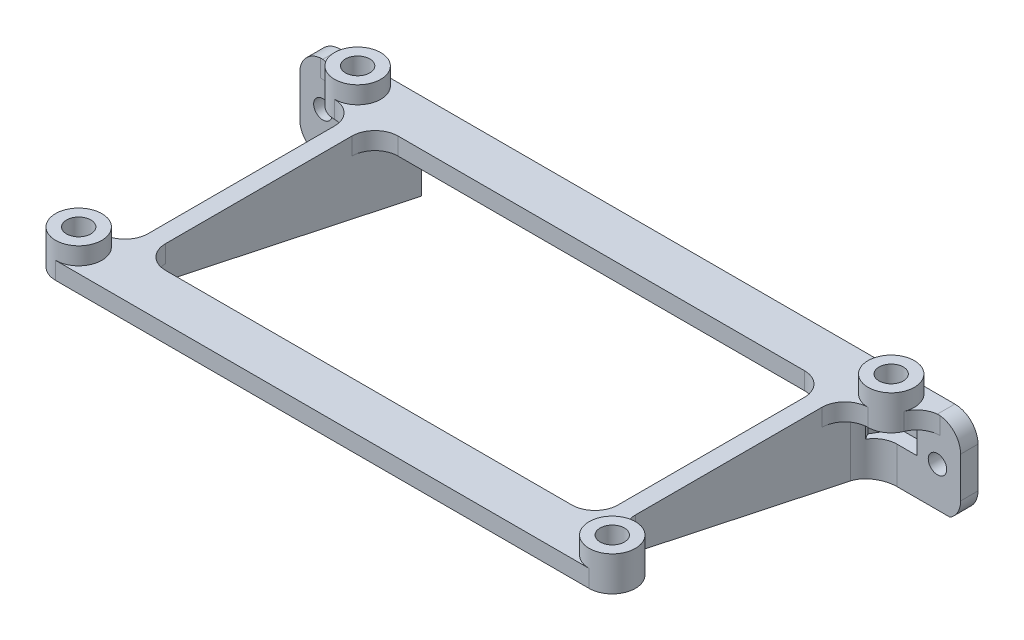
SolidWorks part; units mm, degrees
ref_plane "Front Plane" through (0, 0, 0) normal (0, 0, 1) x (1, 0, 0)
ref_plane "Top Plane" through (0, 0, 0) normal (0, 1, 0) x (1, 0, 0)
ref_plane "Right Plane" through (0, 0, 0) normal (1, 0, 0) x (0, 0, -1)
sketch "Sketch3" plane through (0, 0, 0) normal (0, 1, 0) x (1, 0, 0)
  line L0 (0, 0) -> (92.2, 0) construction
  line L1 (0, 0) -> (0, -48.2) construction
  circle A0 centre (0, 0) radius 2.1
  circle A1 centre (0, 0) radius 4
  circle A2 centre (92.2, 0) radius 2.1
  circle A3 centre (92.2, 0) radius 4
  circle A4 centre (92.2, -48.2) radius 2.1
  circle A5 centre (92.2, -48.2) radius 4
  circle A6 centre (0, -48.2) radius 2.1
  circle A7 centre (0, -48.2) radius 4
  dimension "D1" = 4.2
  dimension "D2" = 8
  dimension "D5" = 92.2
  dimension "D6" = 48.2
  dimension "D3" = 2
  dimension "D4" = 2
extrude "Boss-Extrude2" add sketch "Sketch3" along normal blind 3
sketch "Sketch4" plane through (0, 0, 0) normal (0, 1, 0) x (1, 0, 0)
  line L0 (46.1, 4) -> (46.1, -52.2) construction
  line L1 (0, 4) -> (92.2, 4)
  line L3 (0, -52.2) -> (92.2, -52.2)
  line L5 (7, -4) -> (85.2, -4)
  line L6 (4, -4) -> (4, -44.2)
  line L7 (7, -44.2) -> (85.2, -44.2)
  line L8 (88.2, -4) -> (88.2, -44.2)
  line L9 (7, -4) -> (7, -44.2)
  line L10 (85.2, -4) -> (85.2, -44.2)
  line L11 (4, -4) -> (0, -4)
  line L12 (4, -44.2) -> (0, -44.2)
  line L13 (88.2, -44.2) -> (92.2, -44.2)
  line L14 (88.2, -4) -> (92.2, -4)
  circle A0 centre (0, 0) radius 4 construction
  circle A1 centre (92.2, -48.2) radius 4 construction
  arc A2 (0, 4) -> (0, -4) centre (0, 0) ccw
  circle A3 centre (92.2, 0) radius 4 construction
  circle A4 centre (0, -48.2) radius 4 construction
  circle A5 centre (0, -48.2) radius 2.1 construction
  circle A6 centre (0, 0) radius 2.1 construction
  circle A7 centre (92.2, 0) radius 2.1 construction
  circle A8 centre (92.2, -48.2) radius 2.1 construction
  arc A9 (92.2, -4) -> (92.2, 4) centre (92.2, 0) ccw
  arc A10 (92.2, -52.2) -> (92.2, -44.2) centre (92.2, -48.2) ccw
  arc A11 (0, -44.2) -> (0, -52.2) centre (0, -48.2) ccw
  circle A12 centre (0, -48.2) radius 2.1
  circle A13 centre (0, 0) radius 2.1
  circle A14 centre (92.2, 0) radius 2.1
  circle A15 centre (92.2, -48.2) radius 2.1
  dimension "D1" = 3
extrude "Boss-Extrude3" add sketch "Sketch4" against normal blind 3
ref_plane "Plane1" through (46.1, 0, 0) normal (-1, 0, 0) x (0, 0, 1)
sketch "Sketch6" plane through (4, 0, 0) normal (-1, 0, 0) x (0, 0, 1)
  line L0 (-4, -3) -> (52.2, -3)
  line L1 (52.2, -3) -> (-4, -15)
  line L2 (-4, -15) -> (-4, -3)
  line L3 (4, 0) -> (44.2, 0) construction
  dimension "D1" = 15
extrude "Boss-Extrude5" add sketch "Sketch6" against normal blind 3
mirror "Mirror2" about plane through (46.1, 0, 0) normal (-1, 0, 0) of "Boss-Extrude5"
sketch "Sketch7" plane through (0, 0, -4) normal (0, 0, -1) x (-1, 0, 0)
  line L0 (-103.2, -7.5) -> (-88.2, -7.5) construction
  line L1 (-88.2, -15) -> (-103.2, -15)
  line L2 (-88.2, -15) -> (-88.2, 0)
  line L3 (-88.2, 0) -> (-103.2, 0)
  line L4 (-103.2, -15) -> (-103.2, 0)
  line L5 (-96.2, 3) -> (-96.2, -3) construction
  line L6 (-92.2, 0) -> (0, 0) construction
  circle A0 centre (-99.2, -7.5) radius 1.6
  dimension "D1" = 3.2
  dimension "D2" = 3
  dimension "D3" = 4
extrude "Boss-Extrude6" add sketch "Sketch7" against normal blind 3
mirror "Mirror3" about plane through (46.1, 0, 0) normal (-1, 0, 0) of "Boss-Extrude6"
fillet "Fillet1" radius 4 4 edges at (103.2, 0, -2.5) (103.2, -15, -2.5) (-11, 0, -2.5) (-11, -15, -2.5)
sketch "Sketch8" plane through (46.1, 0, 0) normal (-1, 0, 0) x (0, 0, 1)
  line L0 (-4, -15) -> (-1, -14.3594) construction
  line L1 (-1, -15) -> (-4, -15) construction
  line L2 (-1, -15) -> (-1, -14.3594) construction
  line L3 (-4, -15) -> (-1, -14.3594)
  line L4 (-1, -15) -> (-4, -15)
  line L5 (-1, -15) -> (-1, -14.3594)
extrude "Cut-Extrude2" cut sketch "Sketch8" against normal through all both and the other way through all
fillet "Fillet2" radius 4 12 edges at (96.073, -1.5, -1) (88.2, -8.6797, -1) (-3.873, -1.5, -1) (4, -8.6797, -1) (88.2, -1.5, 4) (88.2, -1.5, 44.2) (85.2, -1.5, 44.2) (85.2, -1.5, 4)
sketch "Sketch9" plane through (0, 0, 0) normal (0, 1, 0) x (1, 0, 0)
  circle A0 centre (0, 0) radius 2.1 construction
  circle A1 centre (92.2, 0) radius 2.1 construction
  circle A2 centre (0, 0) radius 2.1
  circle A3 centre (92.2, 0) radius 2.1
extrude "Cut-Extrude3" cut sketch "Sketch9" against normal blind 8
sketch "Sketch10" plane through (0, -3, 0) normal (0, -1, 0) x (1, 0, 0)
  line L1 (-4.0415, 0) -> (-2.0207, -3.5)
  line L2 (-2.0207, -3.5) -> (2.0207, -3.5)
  line L3 (2.0207, -3.5) -> (4.0415, 0)
  line L4 (4.0415, 0) -> (2.0207, 3.5)
  line L5 (2.0207, 3.5) -> (-2.0207, 3.5)
  line L6 (-2.0207, 3.5) -> (-4.0415, 0)
  circle A0 centre (0, 0) radius 3.5 construction
  dimension "D1" = 7
extrude "Cut-Extrude4" cut sketch "Sketch10" along normal blind 5
mirror "Mirror4" about plane through (46.1, 0, 0) normal (-1, 0, 0) of "Cut-Extrude4"
